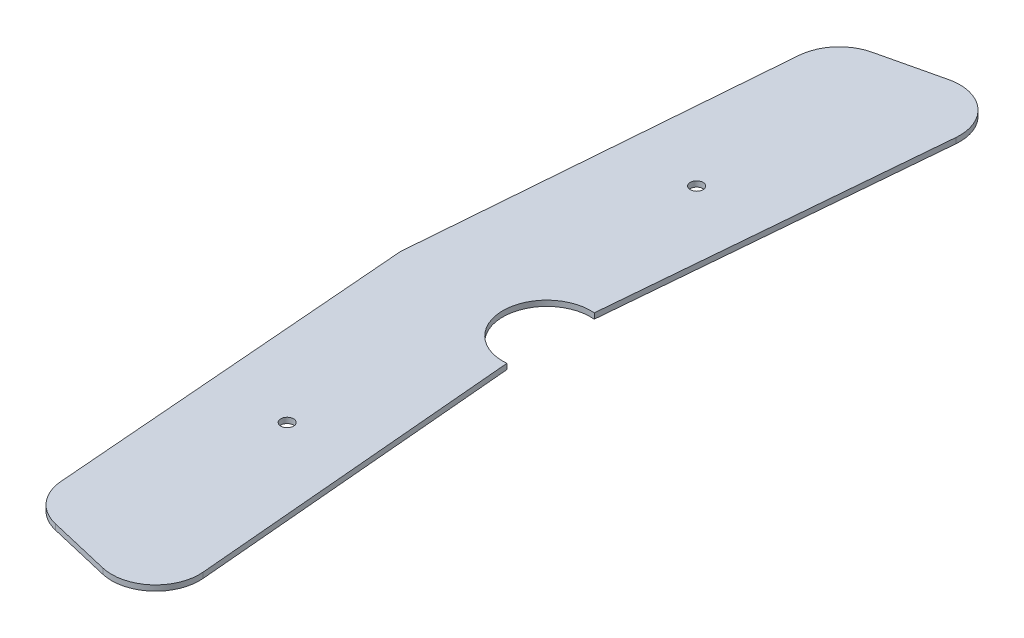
SolidWorks part; units mm, degrees
ref_plane "Front Plane" through (0, 0, 0) normal (0, 0, 1) x (1, 0, 0)
ref_plane "Top Plane" through (0, 0, 0) normal (0, 1, 0) x (1, 0, 0)
ref_plane "Right Plane" through (0, 0, 0) normal (1, 0, 0) x (0, 0, -1)
sketch "Sketch1" plane through (0, 0, 0) normal (0, 1, 0) x (1, 0, 0)
  line L0 (0, 0) -> (40, 0) construction
  line L1 (41.0398, 11.9549) -> (48.9548, 102.9603)
  line L2 (0, 0) -> (8.0378, 100.9524)
  line L3 (17.2516, 111.681) -> (34.2516, 115.6809)
  line L4 (41.0398, -11.9549) -> (48.9548, -102.9603)
  line L5 (17.2516, -111.681) -> (34.2516, -115.6809)
  line L6 (0, 0) -> (8.0378, -100.9524)
  arc A0 (41.0398, 11.9549) -> (41.0398, -11.9549) centre (40, 0) ccw
  circle A1 centre (25, 56) radius 1.75
  arc A2 (48.9548, 102.9603) -> (34.2516, 115.6809) centre (37, 104) ccw
  arc A3 (17.2516, 111.681) -> (8.0378, 100.9524) centre (20, 100) ccw
  circle A4 centre (25, -56) radius 1.75
  arc A5 (48.9548, -102.9603) -> (34.2516, -115.6809) centre (37, -104) cw
  arc A6 (17.2516, -111.681) -> (8.0378, -100.9524) centre (20, -100) cw
  dimension "D1" = 15
  dimension "D4" = 104
  dimension "D5" = 100
  dimension "D2" = 56
  dimension "D3" = 40
  dimension "D6" = 17
  dimension "D7" = 20
extrude "Extrude1" add sketch "Sketch1" along normal blind 1.5
